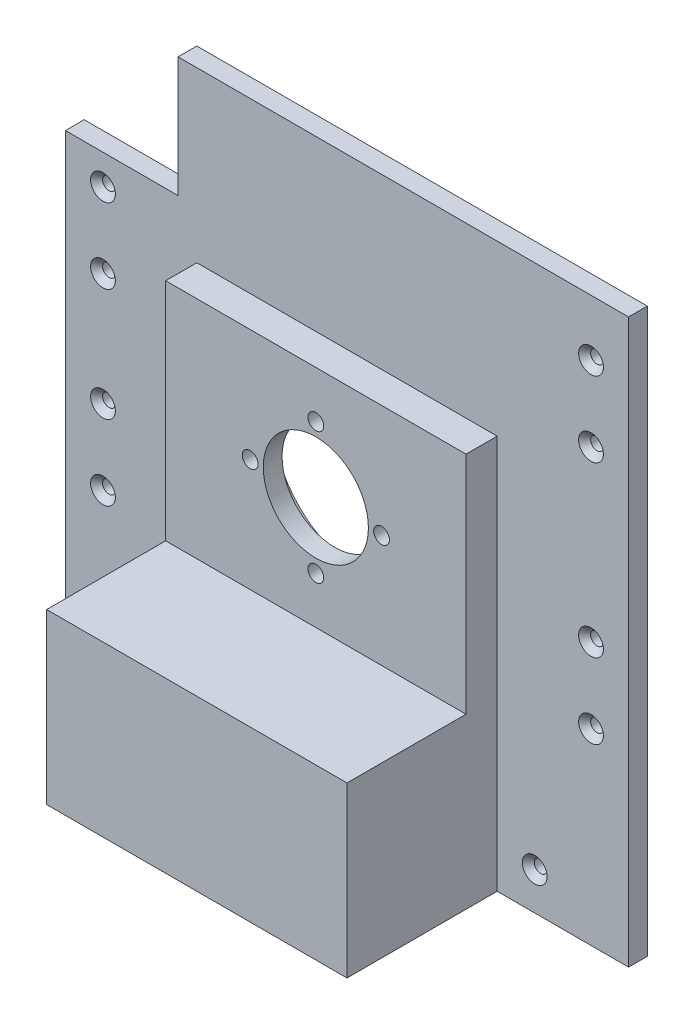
SolidWorks part; units mm, degrees
ref_plane "前视基准面" through (0, 0, 0) normal (0, 0, 1) x (1, 0, 0)
ref_plane "上视基准面" through (0, 0, 0) normal (0, 1, 0) x (1, 0, 0)
ref_plane "右视基准面" through (0, 0, 0) normal (1, 0, 0) x (0, 0, -1)
other "Configuration Table"
sketch "草图1" plane through (0, 0, 0) normal (0, 0, 1) x (1, 0, 0)
  line L1 (-75, 75) -> (75, 75)
  line L2 (-75, 75) -> (-75, -75)
  line L3 (-75, -75) -> (75, -75)
  line L4 (75, 75) -> (75, -75)
  line L5 (-75, 75) -> (75, -75) construction
  line L6 (-75, -75) -> (75, 75) construction
  point P0 (0, 0)
  dimension "D1" = 150
  dimension "D2" = 150
extrude "凸台-拉伸1" add sketch "草图1" along normal blind 5
sketch "草图2" plane through (0, 0, 5) normal (0, 0, 1) x (1, 0, 0)
  line L1 (-40, 30) -> (40, 30)
  line L2 (-40, 30) -> (-40, -30)
  line L3 (-40, -30) -> (40, -30)
  line L4 (40, 30) -> (40, -30)
  line L5 (-40, 30) -> (40, -30) construction
  line L6 (-40, -30) -> (40, 30) construction
  point P0 (0, 0)
  dimension "D1" = 80
  dimension "D2" = 60
extrude "凸台-拉伸2" add sketch "草图2" along normal blind 8.3
sketch "草图3" plane through (0, 0, 5) normal (0, 0, 1) x (1, 0, 0)
  line L0 (-75, -75) -> (75, -75) construction
  line L1 (-40, -30) -> (40, -30)
  line L2 (-40, -30) -> (-40, -75)
  line L3 (-40, -75) -> (40, -75)
  line L4 (40, -30) -> (40, -75)
  line L5 (-75, 75) -> (-75, -75) construction
  dimension "D1" = 45
  dimension "D2" = 80
  dimension "D3" = 35
extrude "凸台-拉伸3" add sketch "草图3" along normal blind 40
sketch "草图4" plane through (0, 0, 0) normal (0, 0, -1) x (-1, 0, 0)
  circle A0 centre (0, 0) radius 25
  dimension "D1" = 50
extrude "切除-拉伸1" cut sketch "草图4" against normal blind 8.3
sketch "草图5" plane through (0, 0, 8.3) normal (0, 0, -1) x (-1, 0, 0)
  circle A0 centre (0, 0) radius 17.5
  dimension "D1" = 35
hole_wizard "M5 螺纹孔1" positions "草图8" profile "草图7" tap size "M5" standard "GB"
sketch "草图8" plane through (0, 0, 8.3) normal (0, 0, -1) x (-1, 0, 0)
  circle A0 centre (0, 0) radius 17.5 construction
  point P0 (0, 17.5)
  point P4 (-17.5, 0)
  point P6 (0, -17.5)
  point P8 (17.5, 0)
sketch "草图7" plane through (0, 17.5, 8.3) normal (1, 0, 0) x (0, 1, 0)
  line L0 (0, 0) -> (0, 13.6618)
  line L1 (0, 13.6618) -> (2.1, 12.4)
  line L2 (2.1, 12.4) -> (2.1, 0)
  line L5 (2.1, 0) -> (0, 0)
  line L10 (0, 13.6618) -> (-2.1, 12.4) construction
  line L11 (0, -6.35) -> (0, 107.95) construction
  dimension "螺纹孔钻头直径" = 4.2
  dimension "螺纹孔钻头深度" = 12.4
  dimension "导头角度" = 118
sketch "草图9" plane through (0, 0, 8.3) normal (0, 0, -1) x (-1, 0, 0)
  circle A0 centre (0, 0) radius 14
  dimension "D1" = 28
extrude "切除-拉伸2" cut sketch "草图9" against normal blind 10
hole_wizard "M3 十字槽沉头木螺钉的锥形沉头孔1" positions "草图10" profile "草图11" countersink size "M3" standard "GB"
sketch "草图10" plane through (0, 0, 5) normal (0, 0, 1) x (1, 0, 0)
  line L0 (-75, 75) -> (-75, -75) construction
  line L1 (75, 75) -> (-75, 75) construction
  line L2 (-75, -75) -> (-40, -75) construction
  point P0 (-65, 35)
  point P2 (-65, 15)
  point P4 (-65, -15)
  point P6 (-65, -35)
  dimension "D1" = 10
  dimension "D2" = 10
  dimension "D3" = 10
  dimension "D4" = 10
  dimension "D5" = 40
  dimension "D6" = 20
  dimension "D7" = 40
  dimension "D8" = 20
sketch "草图11" plane through (-65, 35, 5) normal (1, 0, 0) x (0, -1, 0)
  line L0 (0, 0) -> (0, 12.5215)
  line L1 (0, 12.5215) -> (1.7, 11.5)
  line L2 (1.7, 11.5) -> (1.7, 1.6)
  line L3 (1.7, 1.6) -> (3.3, 0)
  line L5 (3.3, 0) -> (0, 0)
  line L6 (-1.7, 1.6) -> (-3.3, 0) construction
  line L10 (0, 12.5215) -> (-1.7, 11.5) construction
  line L11 (0, -6.35) -> (0, 107.95) construction
  dimension "孔直径" = 3.4
  dimension "孔深度" = 11.5
  dimension "近端锥形沉头孔直径" = 6.6
  dimension "近端锥形沉头孔角度" = 90
  dimension "导头角度" = 118
hole_wizard "M3 十字槽沉头木螺钉的锥形沉头孔2" positions "草图12" profile "草图13" countersink size "M3" standard "GB"
sketch "草图12" plane through (0, 0, 5) normal (0, 0, 1) x (1, 0, 0)
  line L0 (75, 75) -> (-75, 75) construction
  line L1 (75, -75) -> (75, 75) construction
  point P0 (65, 60)
  point P2 (65, 40)
  point P4 (65, -5)
  point P6 (65, -25)
  dimension "D1" = 15
  dimension "D2" = 10
  dimension "D3" = 10
  dimension "D4" = 10
  dimension "D5" = 10
  dimension "D6" = 20
  dimension "D7" = 80
  dimension "D8" = 20
sketch "草图13" plane through (65, 60, 5) normal (1, 0, 0) x (0, -1, 0)
  line L0 (0, 0) -> (0, 12.5215)
  line L1 (0, 12.5215) -> (1.7, 11.5)
  line L2 (1.7, 11.5) -> (1.7, 1.6)
  line L3 (1.7, 1.6) -> (3.3, 0)
  line L5 (3.3, 0) -> (0, 0)
  line L6 (-1.7, 1.6) -> (-3.3, 0) construction
  line L10 (0, 12.5215) -> (-1.7, 11.5) construction
  line L11 (0, -6.35) -> (0, 107.95) construction
  dimension "孔直径" = 3.4
  dimension "孔深度" = 11.5
  dimension "近端锥形沉头孔直径" = 6.6
  dimension "近端锥形沉头孔角度" = 90
  dimension "导头角度" = 118
hole_wizard "M3 十字槽沉头木螺钉的锥形沉头孔3" positions "草图14" profile "草图15" countersink size "M3" standard "GB"
sketch "草图14" plane through (0, 0, 5) normal (0, 0, 1) x (1, 0, 0)
  line L0 (40, -75) -> (75, -75) construction
  line L1 (75, -75) -> (75, 75) construction
  point P0 (50, -65)
  dimension "D1" = 10
  dimension "D2" = 25
sketch "草图15" plane through (50, -65, 5) normal (1, 0, 0) x (0, -1, 0)
  line L0 (0, 0) -> (0, 12.5215)
  line L1 (0, 12.5215) -> (1.7, 11.5)
  line L2 (1.7, 11.5) -> (1.7, 1.6)
  line L3 (1.7, 1.6) -> (3.3, 0)
  line L5 (3.3, 0) -> (0, 0)
  line L6 (-1.7, 1.6) -> (-3.3, 0) construction
  line L10 (0, 12.5215) -> (-1.7, 11.5) construction
  line L11 (0, -6.35) -> (0, 107.95) construction
  dimension "孔直径" = 3.4
  dimension "孔深度" = 11.5
  dimension "近端锥形沉头孔直径" = 6.6
  dimension "近端锥形沉头孔角度" = 90
  dimension "导头角度" = 118
hole_wizard "M3 十字槽沉头木螺钉的锥形沉头孔4" positions "草图16" profile "草图17" countersink size "M3" standard "GB"
sketch "草图16" plane through (0, 0, 5) normal (0, 0, 1) x (1, 0, 0)
  line L0 (-75, -75) -> (-40, -75) construction
  line L1 (-75, 75) -> (-75, -75) construction
  point P0 (-65, -65)
  dimension "D1" = 10
  dimension "D2" = 10
sketch "草图17" plane through (-65, -65, 5) normal (1, 0, 0) x (0, -1, 0)
  line L0 (0, 0) -> (0, 12.5215)
  line L1 (0, 12.5215) -> (1.7, 11.5)
  line L2 (1.7, 11.5) -> (1.7, 1.6)
  line L3 (1.7, 1.6) -> (3.3, 0)
  line L5 (3.3, 0) -> (0, 0)
  line L6 (-1.7, 1.6) -> (-3.3, 0) construction
  line L10 (0, 12.5215) -> (-1.7, 11.5) construction
  line L11 (0, -6.35) -> (0, 107.95) construction
  dimension "孔直径" = 3.4
  dimension "孔深度" = 11.5
  dimension "近端锥形沉头孔直径" = 6.6
  dimension "近端锥形沉头孔角度" = 90
  dimension "导头角度" = 118
sketch "草图18" plane through (0, 0, 5) normal (0, 0, 1) x (1, 0, 0)
  line L0 (75, 75) -> (-75, 75) construction
  line L1 (-45, 75) -> (-75, 75)
  line L2 (-45, 75) -> (-45, 43)
  line L3 (-45, 43) -> (-75, 43)
  line L4 (-75, 75) -> (-75, 43)
  line L5 (-75, 75) -> (-75, -75) construction
  dimension "D1" = 30
  dimension "D2" = 32
extrude "切除-拉伸3" cut sketch "草图18" against normal through all
